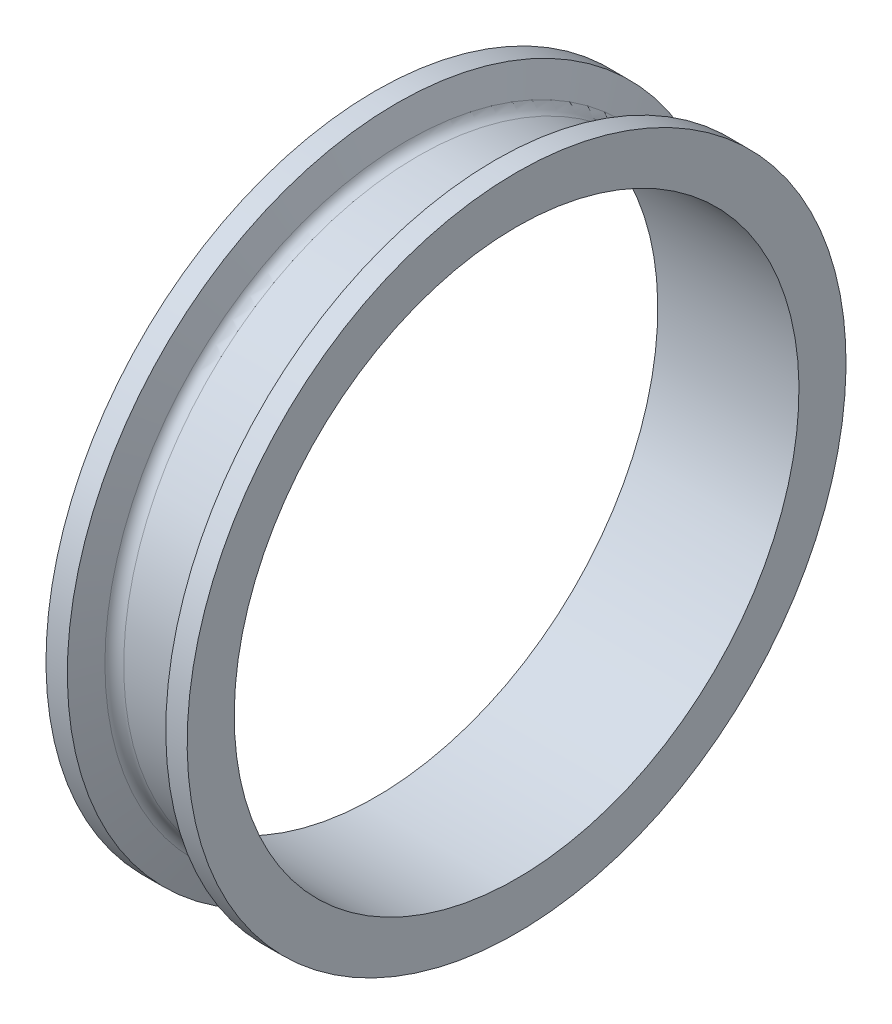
SolidWorks part; units mm, degrees
ref_plane "Front" through (0, 0, 0) normal (0, 0, 1) x (1, 0, 0)
ref_plane "Top" through (0, 0, 0) normal (0, 1, 0) x (1, 0, 0)
ref_plane "Right" through (0, 0, 0) normal (1, 0, 0) x (0, 0, -1)
sketch "Sketch1" plane through (0, 0, 0) normal (0, 0, 1) x (1, 0, 0)
  line L0 (22.4503, 0) -> (0, 0) construction
  line L1 (0, 76.2) -> (0, -76.2) construction
  line L2 (-19.05, 88.9) -> (-13.2842, 88.9)
  line L3 (-13.2842, 88.9) -> (-10.5777, 81.4641)
  line L4 (-19.05, 76.2) -> (19.05, 76.2)
  line L5 (-7.5942, 79.375) -> (7.5942, 79.375)
  line L6 (-19.05, 88.9) -> (-19.05, 76.2)
  line L10 (19.05, 88.9) -> (19.05, 76.2)
  line L13 (13.2842, 88.9) -> (10.5777, 81.4641)
  line L14 (19.05, 88.9) -> (13.2842, 88.9)
  arc A0 (-10.5777, 81.4641) -> (-7.5942, 79.375) centre (-7.5942, 82.55) ccw
  arc A2 (10.5777, 81.4641) -> (7.5942, 79.375) centre (7.5942, 82.55) cw
  dimension "D9" = 3.175
  dimension "D1" = 38.1
  dimension "D2" = 152.4
  dimension "D3" = 177.8
  dimension "D5" = 3.175
  dimension "D6" = 70
  dimension "D8" = 5.7658
revolve "Revolve1" add sketch "Sketch1" angle 360 about L0
